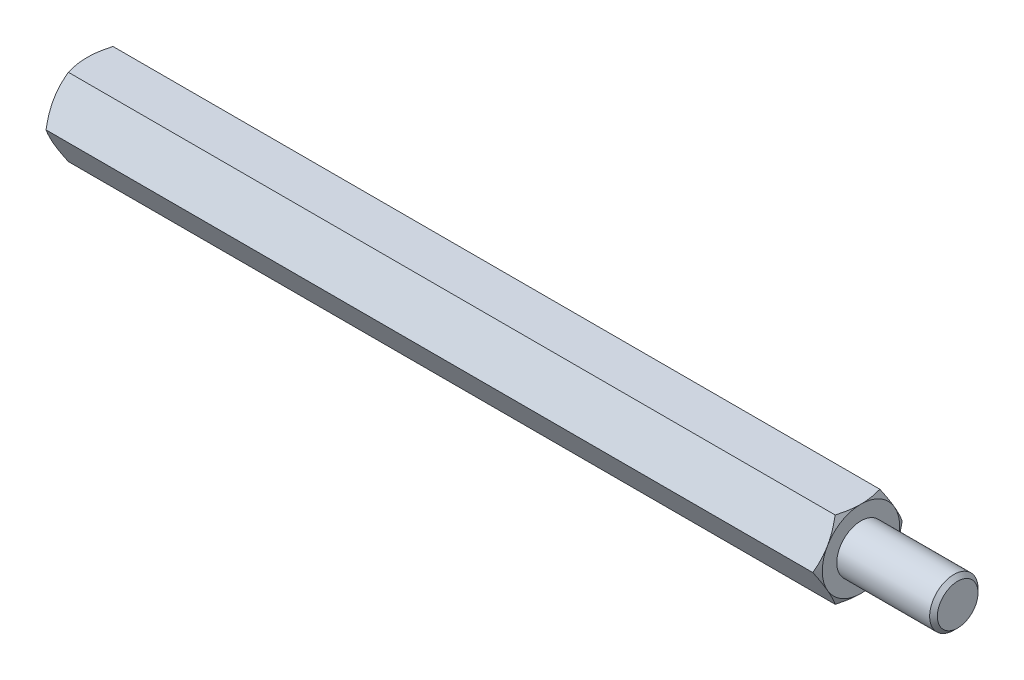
SolidWorks part; units mm, degrees
ref_plane "Front Plane" through (0, 0, 0) normal (0, 0, 1) x (1, 0, 0)
ref_plane "Top Plane" through (0, 0, 0) normal (0, 1, 0) x (1, 0, 0)
ref_plane "Right Plane" through (0, 0, 0) normal (1, 0, 0) x (0, 0, -1)
sketch "Sketch1" plane through (0, 0, 0) normal (1, 0, 0) x (0, 0, -1)
  line L1 (2.3094, 4) -> (-2.3094, 4)
  line L2 (-2.3094, 4) -> (-4.6188, 0)
  line L3 (-4.6188, 0) -> (-2.3094, -4)
  line L4 (-2.3094, -4) -> (2.3094, -4)
  line L5 (2.3094, -4) -> (4.6188, 0)
  line L6 (4.6188, 0) -> (2.3094, 4)
  circle A0 centre (0, 0) radius 4 construction
  dimension "D1" = 8
extrude "Extrude2" add sketch "Sketch1" along normal mid plane 80
sketch "Sketch2" plane through (0, 0, 0) normal (0, 0, 1) x (1, 0, 0)
  line L0 (-40, 4) -> (-38.5, 6.5981)
  line L1 (-40, 7) -> (-40, 4)
  line L3 (0, 0) -> (50000, 0) construction
  arc A0 (-38.5, 6.5981) -> (-40, 7) centre (-39.1962, 7) ccw
  dimension "D1" = 30
  dimension "D2" = 3
revolve "Cut-Revolve1" cut sketch "Sketch2" angle 360 about L3
mirror "Mirror1" about plane through (0, 0, 0) normal (1, 0, 0) of "Cut-Revolve1"
sketch "Sketch3" plane through (-40, 0, 0) normal (-1, 0, 0) x (0, 0, 1)
  circle A0 centre (0, 0) radius 2.1
  dimension "D1" = 4.2
extrude "Extrude3" cut sketch "Sketch3" against normal blind 10
sketch "Sketch4" plane through (0, 0, 0) normal (0, 0, 1) x (1, 0, 0)
  line L0 (-30, 0) -> (-30, 2.1)
  line L1 (39.6427, 0) -> (-39.6427, 0) construction
  line L2 (-30, 2.1) -> (-28.7876, 0)
  line L3 (-28.7876, 0) -> (-30, 0)
  line L4 (-40, 2) -> (-40, -2) construction
  point P4 (-40, 0)
  dimension "D1" = 30
  dimension "D2" = 2.1
  dimension "D3" = 10
revolve "Cut-Revolve2" cut sketch "Sketch4" angle 360 about L3
sketch "Sketch5" plane through (40, 0, 0) normal (1, 0, 0) x (0, 0, -1)
  circle A0 centre (0, 0) radius 2.5
  dimension "D1" = 5
extrude "Extrude4" add sketch "Sketch5" along normal blind 10
chamfer "Chamfer1" distance 0.4 angle 45 1 edges at (50, 0, -2.5)
equation "\"D2@Sketch4\" = \"D1@Sketch3\"/2"
